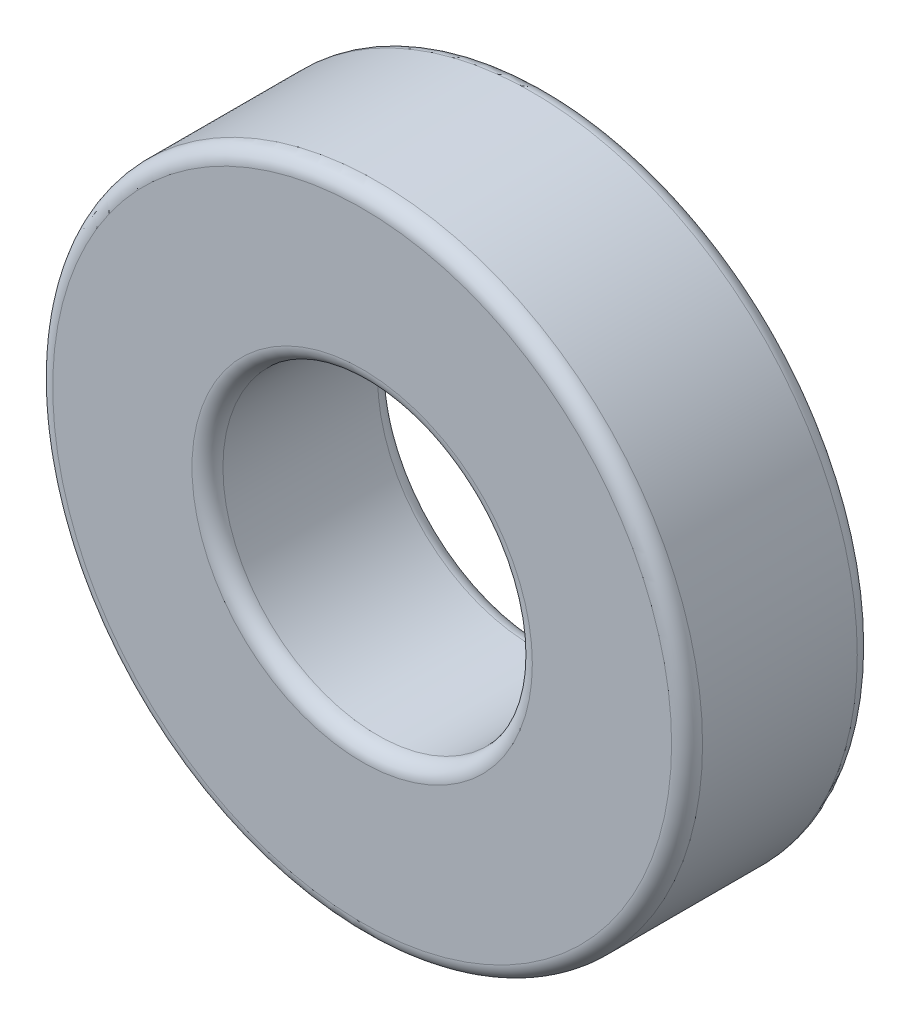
SolidWorks part; units mm, degrees
ref_plane "Plan de face" through (0, 0, 0) normal (0, 0, 1) x (1, 0, 0)
ref_plane "Plan de dessus" through (0, 0, 0) normal (0, 1, 0) x (1, 0, 0)
ref_plane "Plan de droite" through (0, 0, 0) normal (1, 0, 0) x (0, 0, -1)
sketch "Esquisse1" plane through (0, 0, 0) normal (0, 0, 1) x (1, 0, 0)
  circle A0 centre (0, 0) radius 21
  circle A1 centre (0, 0) radius 10
  dimension "D1" = 20
  dimension "D2" = 42
extrude "Extrusion1" add sketch "Esquisse1" along normal blind 12
fillet "Congé1" radius 1 4 edges at (10, 0, 0) (21, 0, 0) (10, 0, 12) (21, 0, 12)
